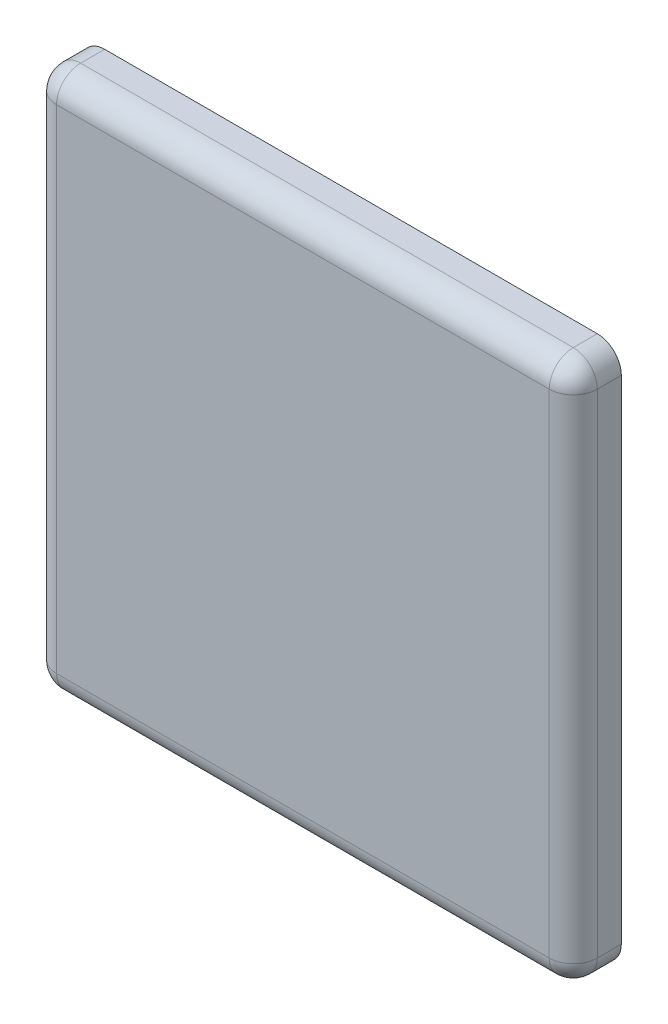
SolidWorks part; units mm, degrees
ref_plane "Plan1" through (0, 0, 0) normal (0, 0, 1) x (1, 0, 0)
ref_plane "Plan2" through (0, 0, 0) normal (0, 1, 0) x (1, 0, 0)
ref_plane "Plan3" through (0, 0, 0) normal (1, 0, 0) x (0, 0, -1)
sketch "Esquisse1" plane through (0, 0, 0) normal (0, 0, 1) x (1, 0, 0)
  line L0 (0, 0) -> (45, 0)
  line L1 (0, 0) -> (0, 45)
  line L2 (45, 45) -> (0, 45)
  line L3 (45, 45) -> (45, 0)
  dimension "D1" = 45
  dimension "D2" = 45
extrude "Base-Extrusion" add sketch "Esquisse1" along normal blind 4
fillet "Congé1" radius 2
